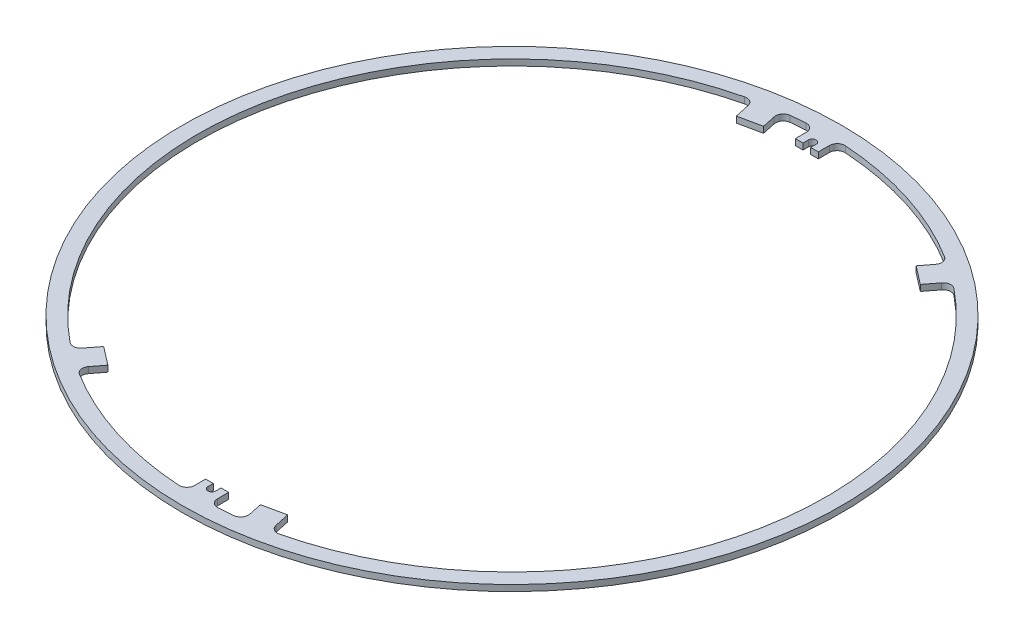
SolidWorks part; units mm, degrees
ref_plane "前视基准面" through (0, 0, 0) normal (0, 0, 1) x (1, 0, 0)
ref_plane "上视基准面" through (0, 0, 0) normal (0, 1, 0) x (1, 0, 0)
ref_plane "右视基准面" through (0, 0, 0) normal (1, 0, 0) x (0, 0, -1)
sketch "草图1" plane through (0, 0, 0) normal (0, 1, 0) x (1, 0, 0)
  circle A0 centre (0, 0) radius 43
  circle A1 centre (0, 0) radius 41
  circle A2 centre (0, 0) radius 35 construction
  dimension "D1" = 86
  dimension "D2" = 2
  dimension "D3" = 70
extrude "凸台-拉伸1" add sketch "草图1" along normal blind 0.8
sketch "草图2" plane through (0, 0.8, 0) normal (0, 1, 0) x (1, 0, 0)
  line L0 (0, 0) -> (0, 47.3857) construction
  line L1 (-1.5, 40.9726) -> (-1.5, 38.4726)
  line L2 (-1.5, 38.4726) -> (1.5, 38.4726)
  line L3 (1.5, 40.9726) -> (1.5, 38.4726)
  line L4 (0, 0) -> (51.4644, 0) construction
  line L5 (1.5, -40.9726) -> (1.5, -38.4726)
  line L6 (-1.5, -40.9726) -> (-1.5, -38.4726)
  line L7 (-1.5, -38.4726) -> (1.5, -38.4726)
  circle A0 centre (0, 0) radius 41 construction
  circle A1 centre (0, 0) radius 41
  point P10 (0, 38.4726)
  dimension "D1" = 2.5
  dimension "D2" = 3
extrude "凸台-拉伸2" add sketch "草图2" against normal up to surface (0.8 mm away) contours L7 L6 L5 M8 | L3 L1 L2 M8
fillet "圆角1" radius 1 2 edges at (1.5, 0.4, -40.9726) (-1.5, 0.4, -40.9726)
fillet "圆角2" radius 1 2 edges at (1.5, 0.4, 40.9726) (-1.5, 0.4, 40.9726)
sketch "草图3" plane through (0, 0, 0) normal (0, -1, 0) x (1, 0, 0)
  line L0 (0, 39.1726) -> (0, 38.4726) construction
  line L1 (1.5, 38.4726) -> (-1.5, 38.4726) construction
  line L2 (-0.5, 39.1726) -> (-0.5, 36.1726)
  line L3 (-0.5, 36.1726) -> (0.5, 36.1726)
  line L4 (0.5, 36.1726) -> (0.5, 39.1726)
  line L5 (0, 0) -> (11.294, 0) construction
  line L6 (0, -39.1726) -> (0, -38.4726) construction
  line L7 (0.5, -36.1726) -> (0.5, -39.1726)
  line L8 (-0.5, -36.1726) -> (0.5, -36.1726)
  line L9 (-0.5, -39.1726) -> (-0.5, -36.1726)
  arc A0 (0.5, 39.1726) -> (-0.5, 39.1726) centre (0, 39.1726) ccw
  arc A1 (0.5, -39.1726) -> (-0.5, -39.1726) centre (0, -39.1726) cw
  dimension "D1" = 1
  dimension "D2" = 3
  dimension "D3" = 0.7
extrude "切除-拉伸1" cut sketch "草图3" against normal through all
sketch "草图4" plane through (0, 0.8, 0) normal (0, 1, 0) x (1, 0, 0)
  line L0 (0, 0) -> (-24.9592, -32.5275) construction
  line L1 (0, 0) -> (0, -48.4381) construction
  line L2 (-24.9592, -32.5275) -> (-23.1329, -30.1474)
  line L3 (-23.1329, -30.1474) -> (-20.7529, -31.9737)
  line L4 (-20.7529, -31.9737) -> (-22.5123, -34.2666)
  line L5 (24.9592, 32.5275) -> (23.1329, 30.1474)
  line L6 (23.1329, 30.1474) -> (20.7529, 31.9737)
  line L7 (20.7529, 31.9737) -> (22.5123, 34.2666)
  arc A0 (-2.5625, 40.9198) -> (-2.5625, -40.9198) centre (0, 0) ccw construction
  arc A1 (-24.9592, -32.5275) -> (-22.5123, -34.2666) centre (0, 0) ccw
  arc A2 (24.9592, 32.5275) -> (22.5123, 34.2666) centre (0, 0) ccw
  point P16 (0, 0)
  dimension "D1" = 3
  dimension "D2" = 3
  dimension "D4" = 37.5
  dimension "D3" = 2
extrude "凸台-拉伸3" add sketch "草图4" against normal up to surface (0.8 mm away)
fillet "圆角3" radius 1 4 edges at (24.9592, 0.4, -32.5275) (22.5123, 0.4, -34.2666) (-22.5123, 0.4, 34.2666) (-24.9592, 0.4, 32.5275)
sketch "草图5" plane through (0, 0, 0) normal (0, -1, 0) x (1, 0, 0)
  line L0 (-23.1329, 30.1474) -> (0, 0) construction
  line L1 (0, 0) -> (8.5244, 40.1041) construction
  line L2 (8.5244, 40.1041) -> (7.9006, 37.1696)
  line L3 (7.9006, 37.1696) -> (4.9662, 37.7933)
  line L4 (4.9662, 37.7933) -> (5.5671, 40.6203)
  line L5 (-4.9662, -37.7933) -> (-5.5671, -40.6203)
  line L6 (-7.9006, -37.1696) -> (-4.9662, -37.7933)
  line L7 (-8.5244, -40.1041) -> (-7.9006, -37.1696)
  arc A0 (25.7646, -31.8933) -> (2.5625, 40.9198) centre (0, 0) ccw construction
  arc A1 (8.5244, 40.1041) -> (5.5671, 40.6203) centre (0, 0) ccw
  arc A2 (-8.5244, -40.1041) -> (-5.5671, -40.6203) centre (0, 0) ccw
  point P17 (0, 0)
  dimension "D1" = 49.5
  dimension "D2" = 3
  dimension "D3" = 3
  dimension "D4" = 2
extrude "凸台-拉伸4" add sketch "草图5" against normal up to surface (0.8 mm away)
fillet "圆角4" radius 1 4 edges at (-5.5671, 0.4, -40.6203) (-8.5244, 0.4, -40.1041) (5.5671, 0.4, 40.6203) (8.5244, 0.4, 40.1041)
